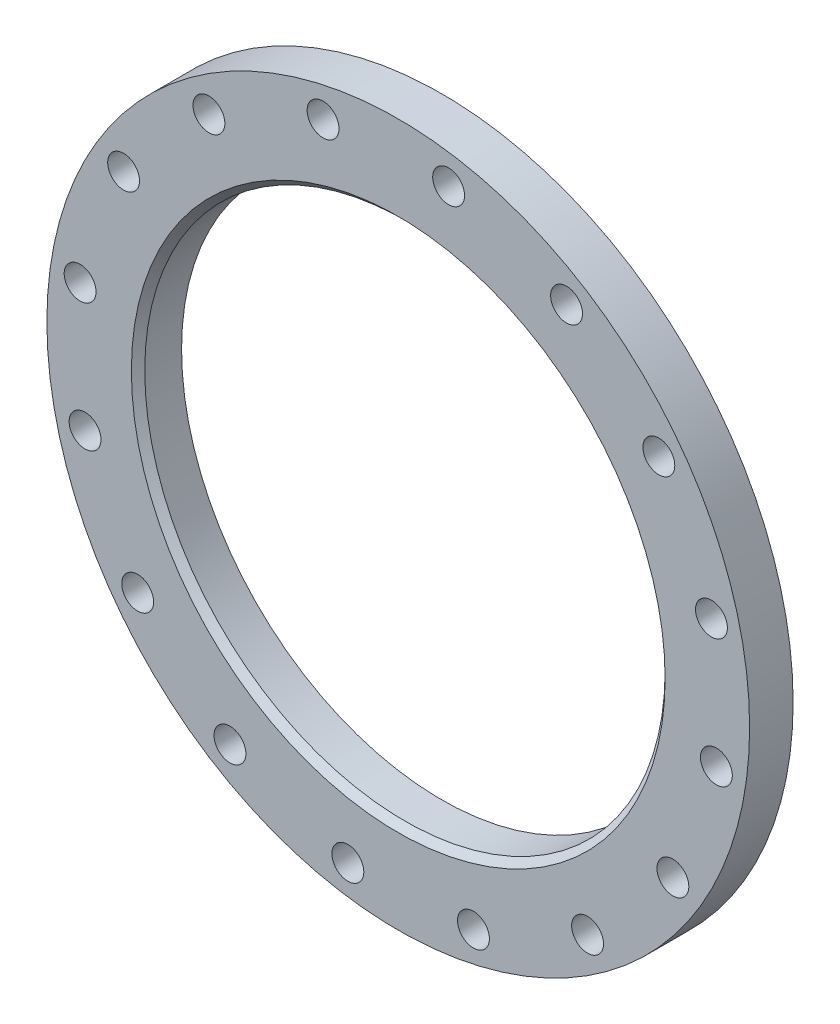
SolidWorks part; units mm, degrees
ref_plane "Front" through (0, 0, 0) normal (0, 0, 1) x (1, 0, 0)
ref_plane "Top" through (0, 0, 0) normal (0, 1, 0) x (1, 0, 0)
ref_plane "Right" through (0, 0, 0) normal (1, 0, 0) x (0, 0, -1)
sketch "Sketch1" plane through (0, 0, 0) normal (0, 0, 1) x (1, 0, 0)
  circle A0 centre (0, 0) radius 420
  circle A1 centre (0, 0) radius 311
  dimension "D1" = 840
  dimension "D2" = 622
extrude "Extrude1" add sketch "Sketch1" along normal blind 52
chamfer "Chamfer1" distance 8 angle 45 1 edges at (311, 0, 52)
sketch "Sketch2" plane through (0, 0, 52) normal (0, 0, 1) x (1, 0, 0)
  line L0 (0, 108.4216) -> (0, 0) construction
  line L1 (0, 0) -> (60.2273, 380.26) construction
  circle A0 centre (0, 0) radius 385 construction
  circle A1 centre (60.2273, 380.26) radius 19.05
  dimension "D1" = 770
  dimension "D2" = 38.1
  dimension "D3" = 9
extrude "Cut-Extrude1" cut sketch "Sketch2" against normal through all
pattern_circular "CirPattern1" count 16 over 360 about axis through (0, 0, 0) along (0, 0, 1) of "Cut-Extrude1"
